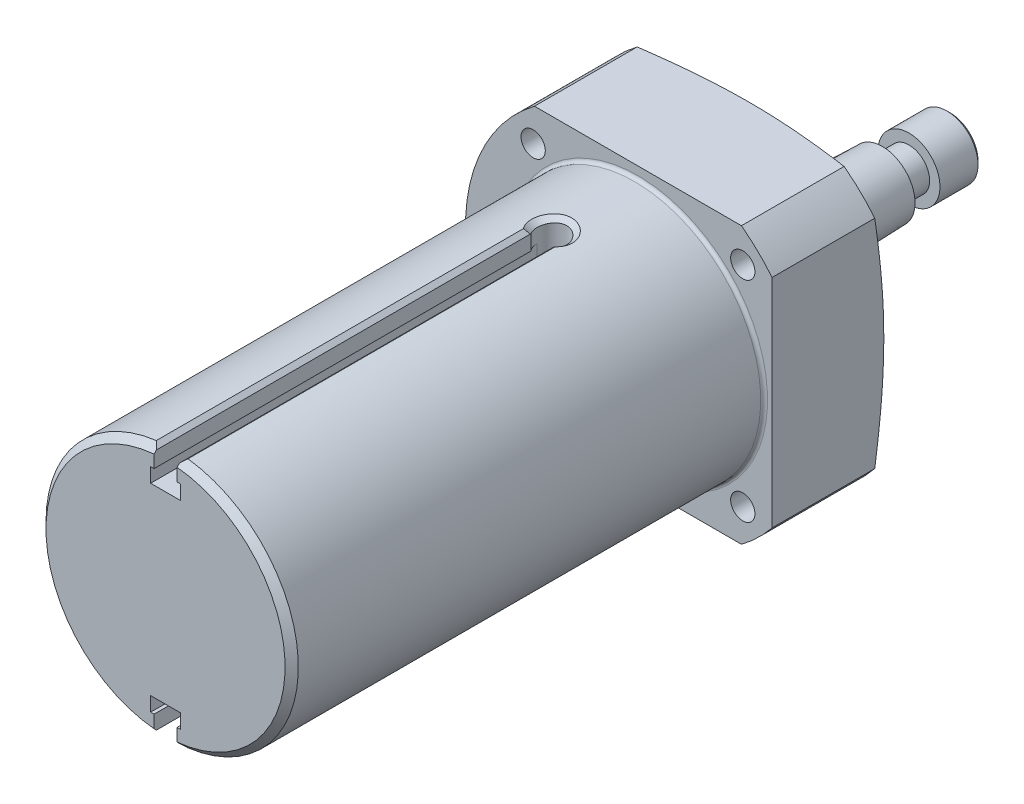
SolidWorks part; units mm, degrees
ref_plane "Front Plane" through (0, 0, 0) normal (0, 0, 1) x (1, 0, 0)
ref_plane "Top Plane" through (0, 0, 0) normal (0, 1, 0) x (1, 0, 0)
ref_plane "Right Plane" through (0, 0, 0) normal (1, 0, 0) x (0, 0, -1)
sketch "Sketch1" plane through (0, 0, 0) normal (0, 0, 1) x (1, 0, 0)
  line L0 (0, 0) -> (62.0084, 0) construction
  line L1 (-23.8125, 31.75) -> (23.8125, 31.75)
  line L2 (30.861, 24.9539) -> (30.861, -24.9539)
  line L3 (-23.8125, -31.75) -> (23.8125, -31.75)
  arc A0 (-23.8125, 31.75) -> (-23.8125, -31.75) centre (0, 0) ccw
  arc A1 (30.861, 24.9539) -> (23.8125, 31.75) centre (0, 0) ccw
  arc A2 (23.8125, -31.75) -> (30.861, -24.9539) centre (0, 0) ccw
  dimension "D1" = 79.375
  dimension "D2" = 63.5
  dimension "D3" = 30.861
extrude "Extrude1" add sketch "Sketch1" along normal blind 138.938
sketch "Sketch2" plane through (0, 0, 0) normal (0, 1, 0) x (1, 0, 0)
  line L0 (0, 0) -> (0, -96.9332) construction
  line L1 (-39.6875, -30.226) -> (-29.0322, -30.226)
  line L2 (-39.6875, 0) -> (-39.6875, -138.938) construction
  line L3 (-29.0322, -30.226) -> (-29.0322, -138.938)
  line L5 (-11.7475, 0) -> (-39.6875, -6.604)
  line L6 (23.8125, 0) -> (-23.8125, 0) construction
  line L7 (-29.0322, -138.938) -> (-39.6875, -138.938)
  line L8 (-39.6875, -138.938) -> (-39.6875, -30.226)
  line L9 (-39.6875, -6.604) -> (-39.6875, 0)
  line L10 (-23.8125, 0) -> (-39.6875, 0) construction
  line L11 (-39.6875, 0) -> (-11.7475, 0)
  dimension "D1" = 108.712
  dimension "D2" = 58.0644
  dimension "D5" = 23.495
  dimension "D6" = 6.604
revolve "Cut-Revolve1" cut sketch "Sketch2" angle 360 about L0
sketch "Sketch4" plane through (0, 0, 0) normal (0, 1, 0) x (1, 0, 0)
  line L0 (0, 0) -> (0, -99.9671) construction
  line L1 (7.9311, 0) -> (7.9311, 13.081)
  line L2 (11.7475, 0) -> (-11.7475, 0) construction
  line L3 (7.9311, 13.081) -> (7.5247, 26.0129)
  line L4 (7.5247, 26.0129) -> (0, 26.0129)
  line L5 (-23.8125, -30.226) -> (23.8125, -30.226) construction
  line L7 (0, 26.0129) -> (0, 0)
  line L8 (0, 0) -> (7.9311, 0)
  dimension "D1" = 1.8
  dimension "D2" = 43.307
  dimension "D4" = 15.8623
  dimension "D5" = 15.0495
  dimension "D6" = 12.9319
revolve "Revolve1" add sketch "Sketch4" angle 360 about L0
hole_wizard "Hole1" positions "Sketch6" profile "Sketch5" legacy
sketch "Sketch6" plane through (0, 0, -26.0129) normal (0, 0, -1) x (-1, 0, 0)
  circle A0 centre (0, 0) radius 7.5247 construction
  point P0 (0, 0)
sketch "Sketch5" plane through (0, 0, -26.0129) normal (1, 0, 0) x (0, 1, 0)
  line L0 (0, 0) -> (0, 21.4347)
  line L1 (0, 21.4347) -> (3.9687, 19.05)
  line L2 (3.9687, 19.05) -> (3.9688, 0)
  line L4 (3.9688, 0) -> (0, 0)
  line L6 (0, 21.4347) -> (-3.9687, 19.05) construction
  line L7 (0, -4.2442) -> (0, 117.3081) construction
  dimension "Diameter" = 7.9375
  dimension "Depth" = 19.05
  dimension "Drill Angle" = 118
hole_wizard "Hole2" positions "Sketch10" profile "Sketch9" legacy
sketch "Sketch10" plane through (4.4648, 0.3939, 0) normal (0, 0, 1) x (1, 0, 0)
  line L1 (-4.4648, -0.3939) -> (19.5659, -0.3939) construction
  line L2 (-4.4648, -0.3939) -> (19.6561, 23.7271) construction
  circle A0 centre (-4.4648, -0.3939) radius 34.1122 construction
  point P0 (19.6561, 23.7271)
  dimension "D2" = 68.2244
  dimension "D1" = 45
sketch "Sketch9" plane through (24.121, 24.121, 0) normal (1, 0, 0) x (0, 1, 0)
  line L0 (0, 0) -> (0, 30.227)
  line L1 (0, 30.227) -> (2.794, 30.227)
  line L2 (2.794, 30.227) -> (2.794, 10.1092)
  line L3 (2.794, 10.1092) -> (4.7625, 10.1092)
  line L4 (4.7625, 10.1092) -> (4.7625, 0)
  line L5 (4.7625, 0) -> (0, 0)
  line L6 (0, 110) -> (0, -10) construction
  dimension "Diameter" = 5.588
  dimension "Depth" = 30.227
  dimension "C-Bore Diameter" = 9.525
  dimension "C-Bore Depth" = 10.1092
pattern_circular "CirPattern1" count 4 over 360 about axis through (0, 0, 0) along (0, 0, 1) of "Hole2"
ref_plane "Plane1" through (0, 0, 22.3012) normal (0, 0, 1) x (1, 0, 0)
sketch "Sketch11" plane through (0, 0, 22.3012) normal (0, 0, 1) x (1, 0, 0)
  line L0 (0, 0) -> (19.628, -9.1527) construction
  line L1 (0, 0) -> (27.0444, 0) construction
  line L2 (-75.2065, 30.4731) -> (-29.166, 9.0041)
  line L3 (-29.166, 9.0041) -> (-27.4056, 12.7794)
  line L4 (-27.4056, 12.7794) -> (-73.446, 34.2484)
  line L5 (-73.446, 34.2484) -> (-75.2065, 30.4731)
  dimension "D1" = 25
  dimension "D2" = 30.2387
  dimension "D3" = 8.3312
  dimension "D4" = 50.8
revolve "Cut-Revolve2" cut sketch "Sketch11" angle 360 about L0
mirror "Mirror1" about plane through (0, 0, 0) normal (0, 1, 0) of "Cut-Revolve2"
sketch "Sketch12" plane through (0, 0, 138.938) normal (0, 0, 1) x (1, 0, 0)
  line L0 (0, 0) -> (0, 26.7352) construction
  line L1 (-2.6416, 50.8) -> (-2.6416, 24.4602)
  line L2 (-2.6416, 24.4602) -> (-3.429, 24.4602)
  line L3 (-3.429, 24.4602) -> (-3.429, 21.1582)
  line L4 (-3.429, 21.1582) -> (3.429, 21.1582)
  line L5 (3.429, 24.4602) -> (3.429, 21.1582)
  line L6 (2.6416, 24.4602) -> (3.429, 24.4602)
  line L7 (2.6416, 50.8) -> (2.6416, 24.4602)
  line L8 (-2.6416, 50.8) -> (2.6416, 50.8)
  dimension "D1" = 5.2832
  dimension "D2" = 6.858
  dimension "D3" = 3.302
  dimension "D4" = 21.1582
  dimension "D5" = 50.8
extrude "Cut-Extrude1" cut sketch "Sketch12" against normal blind 88.9
sketch "Sketch13" plane through (0, 0, 138.938) normal (0, 0, 1) x (1, 0, 0)
  line L0 (0, 0) -> (32.0428, 0) construction
  line L1 (0, 0) -> (0, -27.5102) construction
  line L2 (-3.429, -21.1582) -> (3.429, -21.1582)
  line L3 (3.429, -21.1582) -> (3.429, -24.4602)
  line L4 (3.429, -24.4602) -> (2.6416, -24.4602)
  line L5 (2.6416, -24.4602) -> (2.6416, -50.8)
  line L6 (2.6416, -50.8) -> (-2.6416, -50.8)
  line L7 (-3.429, 21.1582) -> (3.429, 21.1582) construction
  line L8 (3.429, 24.4602) -> (3.429, 21.1582) construction
  line L9 (2.6416, 50.8) -> (2.6416, 24.4602) construction
  line L10 (-2.6416, -24.4602) -> (-2.6416, -50.8)
  line L11 (-3.429, -24.4602) -> (-2.6416, -24.4602)
  line L12 (-3.429, -21.1582) -> (-3.429, -24.4602)
extrude "Cut-Extrude2" cut sketch "Sketch13" against normal blind 73.152
sketch "Sketch14" plane through (0, 31.75, 0) normal (0, 1, 0) x (1, 0, 0)
  line L0 (-2.6416, -50.038) -> (2.6416, -50.038) construction
  circle A0 centre (0, -50.038) radius 3.429
  dimension "D1" = 3.429
extrude "Cut-Extrude3" cut sketch "Sketch14" against normal up to surface (10.5918 mm away)
sketch "Sketch15" plane through (0, -31.75, 0) normal (0, -1, 0) x (1, 0, 0)
  line L0 (3.429, 65.786) -> (-3.429, 65.786) construction
  circle A0 centre (0, 65.786) radius 3.429
  dimension "D1" = 3.429
extrude "Cut-Extrude4" cut sketch "Sketch15" against normal up to surface (10.5918 mm away)
sketch "Sketch16" plane through (0, 0, 0) normal (0, 1, 0) x (1, 0, 0)
  line L0 (0, 0) -> (0, -122.9241) construction
  line L1 (4.7625, 26.0129) -> (4.7625, 32.131)
  line L2 (7.5247, 26.0129) -> (-7.5247, 26.0129) construction
  line L3 (4.7625, 32.131) -> (7.1374, 32.131)
  line L4 (7.1374, 32.131) -> (7.1374, 40.894)
  line L5 (7.1374, 40.894) -> (6.3754, 41.656)
  line L6 (6.3754, 41.656) -> (0, 41.656)
  line L7 (0, 41.656) -> (0, 26.0129)
  line L8 (0, 26.0129) -> (4.7625, 26.0129)
  line L9 (-7.9311, 13.081) -> (7.9311, 13.081) construction
  dimension "D1" = 9.525
  dimension "D2" = 19.05
  dimension "D3" = 14.2748
  dimension "D4" = 9.525
  dimension "D5" = 45
  dimension "D6" = 12.7508
revolve "Revolve2" add sketch "Sketch16" angle 360 about L0
sketch "Sketch17" plane through (0, 0, -41.656) normal (0, 0, -1) x (-1, 0, 0)
  line L1 (3.9624, -2.2877) -> (3.9624, 2.2877)
  line L2 (3.9624, 2.2877) -> (0, 4.5754)
  line L3 (0, 4.5754) -> (-3.9624, 2.2877)
  line L4 (-3.9624, 2.2877) -> (-3.9624, -2.2877)
  line L5 (-3.9624, -2.2877) -> (0, -4.5754)
  line L6 (0, -4.5754) -> (3.9624, -2.2877)
  circle A0 centre (0, 0) radius 3.9624 construction
  dimension "D1" = 7.9248
extrude "Cut-Extrude5" cut sketch "Sketch17" against normal blind 6.35
chamfer "Chamfer1" distance 1.524 angle 45 2 edges at (-29.0322, 0, 138.938) (29.0322, 0, 138.938)
fillet "Fillet1" radius 0.7874 1 edges at (-29.0322, 0, 30.226)
chamfer "Chamfer2" distance 0.9906 angle 48.55 6 edges at (2.6416, -28.9118, 102.6932) (-0.3835, -29.0297, 69.1935) (-2.6416, -28.9118, 102.6932) (-2.6416, 28.9118, 94.8192) (-0.3835, 29.0297, 46.6305) (2.6416, 28.9118, 94.8192)
